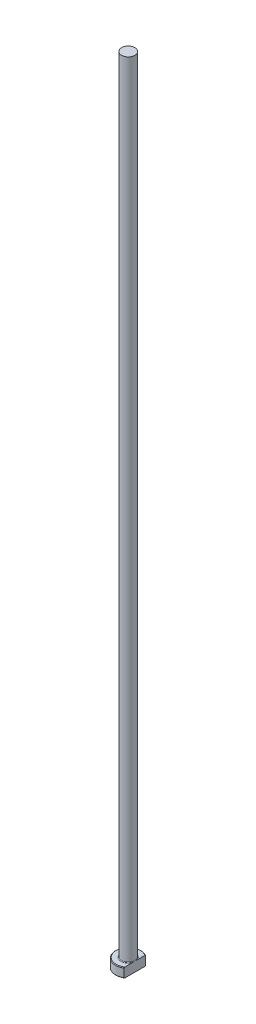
SolidWorks part; units mm, degrees
ref_plane "Front Plane" through (0, 0, 0) normal (0, 0, 1) x (1, 0, 0)
ref_plane "Top Plane" through (0, 0, 0) normal (0, 1, 0) x (1, 0, 0)
ref_plane "Right Plane" through (0, 0, 0) normal (1, 0, 0) x (0, 0, -1)
sketch "Sketch1" plane through (0, 0, 0) normal (0, 0, 1) x (1, 0, 0)
  line L0 (0, 259.9588) -> (0, -15.1925) construction
  line L1 (0, 0) -> (-4, 0)
  line L2 (-4, 0) -> (-4, 3)
  line L3 (-4, 3) -> (-2.1, 3)
  line L4 (-2.1, 3) -> (-2.1, 250)
  line L5 (-2.1, 250) -> (0, 250)
  line L6 (0, 250) -> (0, 0)
  dimension "L" = 250
  dimension "H" = 8
  dimension "T" = 3
  dimension "D" = 4.2
revolve "Revolve1" add sketch "Sketch1" angle 360 about L0
chamfer "Chamfer1" distance 0.2 angle 45 2 edges at (0, 3, 4) (0, 0, 4)
fillet "Fillet1" radius 0.2 1 edges at (0, 3, 2.1)
sketch "Sketch2" plane through (0, 0, 0) normal (0, 1, 0) x (1, 0, 0)
  line L0 (2.1, 3.4044) -> (2.1, -3.4044)
  circle A0 centre (0, 0) radius 4 construction
  arc A1 (2.1, -3.4044) -> (2.1, 3.4044) centre (0, 0) ccw
  circle A2 centre (0, 0) radius 2.1 construction
extrude "KEY" cut sketch "Sketch2" along normal through all
